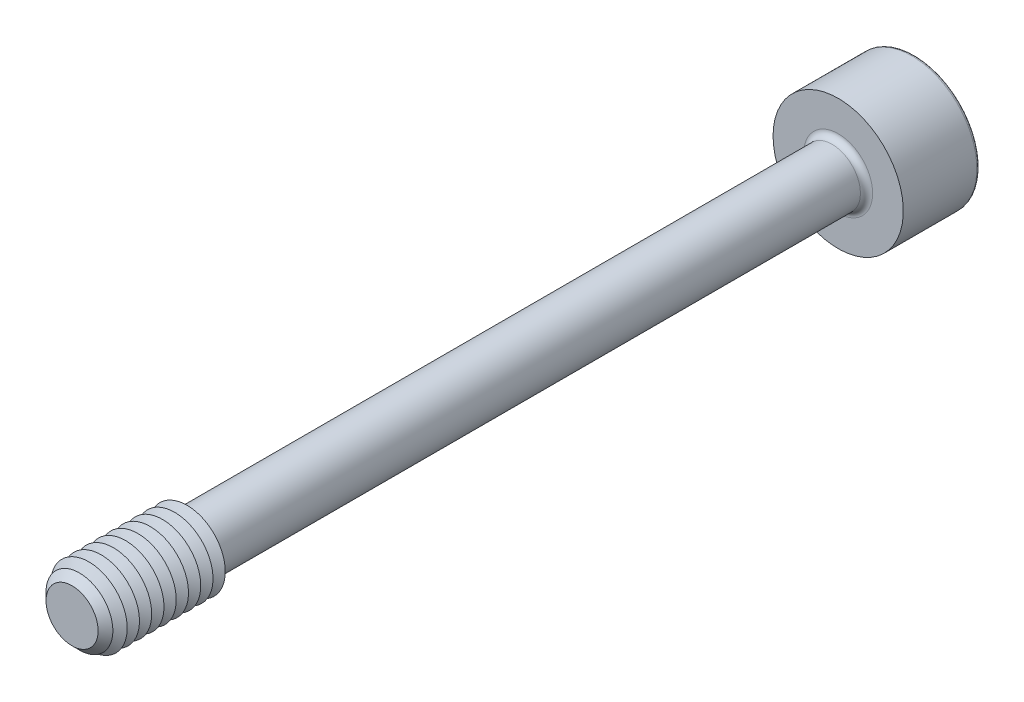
SolidWorks part; units mm, degrees
ref_plane "Front Plane" through (0, 0, 0) normal (0, 0, 1) x (1, 0, 0)
ref_plane "Top Plane" through (0, 0, 0) normal (0, 1, 0) x (1, 0, 0)
ref_plane "Right Plane" through (0, 0, 0) normal (1, 0, 0) x (0, 0, -1)
sketch "Sketch1" plane through (0, 0, 0) normal (0, 0, 1) x (1, 0, 0)
  circle A0 centre (0, 0) radius 1.85
  dimension "D1" = 3.7
extrude "Extrude1" add sketch "Sketch1" along normal mid plane 50
sketch "Sketch2" plane through (0, 0, 0) normal (1, 0, 0) x (0, 0, -1)
  line L0 (-25, 0) -> (-25, 2.5)
  line L1 (-25, 1.85) -> (-25, -1.85) construction
  line L2 (-25, 2.5) -> (-17.5, 2.5)
  line L3 (-17.5, 2.5) -> (-17.1247, 1.85)
  line L4 (25, 1.85) -> (-25, 1.85) construction
  line L5 (-17.1247, 1.85) -> (-17.1247, 0)
  line L6 (-17.1247, 0) -> (-25, 0)
  dimension "D1" = 2.5
  dimension "D2" = 120
  dimension "D3" = 7.5
revolve "Revolve1" add sketch "Sketch2" angle 360 about L6
chamfer "Chamfer1" distance 0.8 angle 45 1 edges at (0, 2.5, 25)
sketch "Sketch3" plane through (0, 0, -25) normal (0, 0, -1) x (-1, 0, 0)
  circle A0 centre (0, 0) radius 4.25
  dimension "D1" = 8.5
extrude "Extrude2" add sketch "Sketch3" along normal blind 5
sketch "Sketch4" plane through (-13.7, 0, -30) normal (0, 0, 1) x (1, 0, 0)
  line L2 (12.5453, -2) -> (14.8547, -2)
  line L3 (14.8547, -2) -> (16.0094, 0)
  line L4 (16.0094, 0) -> (14.8547, 2)
  line L6 (14.8547, 2) -> (12.5453, 2)
  line L7 (12.5453, 2) -> (11.3906, 0)
  line L8 (11.3906, 0) -> (12.5453, -2)
  circle A0 centre (13.7, 0) radius 2 construction
  dimension "D1" = 4
extrude "Extrude3" cut sketch "Sketch4" along normal blind 4
fillet "Fillet1" radius 0.4 1 edges at (-1.85, 0, -25)
fillet "Fillet2" radius 0.2 1 edges at (-4.25, 0, -30)
sketch "Sketch5" plane through (0, 0, 0) normal (1, 0, 0) x (0, 0, -1)
  line L0 (26, 0) -> (26, -2)
  line L1 (26, -2) -> (24.8453, 0)
  line L2 (24.8453, 0) -> (26, 0)
  dimension "D1" = 30
revolve "Cut-Revolve1" cut sketch "Sketch5" angle 360 about L2
sketch "Sketch6" plane through (0, 0, 0) normal (1, 0, 0) x (0, 0, -1)
  line L0 (1.332, 0) -> (-13.289, 0) construction
sketch "Sketch7" plane through (0, 0, 0) normal (1, 0, 0) x (0, 0, -1)
  line L0 (-17.5, 2.5) -> (-17.9, 1.8072)
  line L1 (-17.9, 1.8072) -> (-18.3, 2.5)
  line L2 (-17.5, 2.5) -> (-24.2, 2.5) construction
  line L3 (-18.3, 2.5) -> (-17.5, 2.5)
  dimension "D1" = 0.8
revolve "Cut-Revolve2" cut sketch "Sketch7" angle 360 about L0
pattern_linear "LPattern1" count 9 spacing 0.8 along (0, 0, 1) of "Cut-Revolve2"
